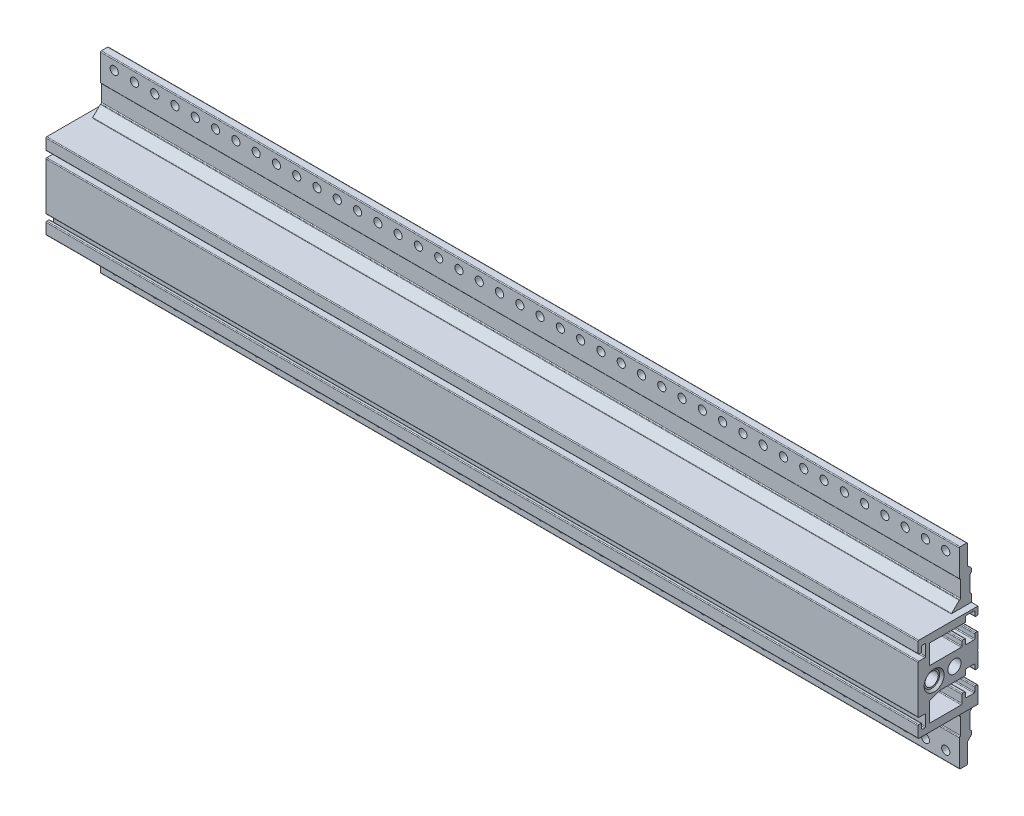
SolidWorks part; units mm, degrees
ref_plane "前视基准面" through (0, 0, 0) normal (0, 0, 1) x (1, 0, 0)
ref_plane "上视基准面" through (0, 0, 0) normal (0, 1, 0) x (1, 0, 0)
ref_plane "右视基准面" through (0, 0, 0) normal (1, 0, 0) x (0, 0, -1)
sketch "草图2" plane through (0, 0, 0) normal (1, 0, 0) x (0, 0, -1)
  line L0 (8.2, 24.1) -> (9.8, 24.1)
  line L1 (-3.8, 10.65) -> (5.9172, 10.65)
  line L2 (7.2, 5.2) -> (7.7, 5.2)
  line L3 (10.4, 5.2) -> (10.8, 5.2)
  line L4 (-1, 3.8) -> (6.8, 3.8)
  line L5 (8.1, 3.8) -> (10, 3.8)
  line L6 (8.1, 10.1) -> (10, 10.1)
  line L7 (-1, 8.7) -> (7.7, 8.7)
  line L8 (10.4, 8.7) -> (10.8, 8.7)
  line L9 (-3.8, 7.65) -> (-3.3, 7.65)
  line L10 (-2.9, 9.15) -> (-2.3, 9.15)
  line L11 (-3.8, 6.1) -> (-2.3, 6.1)
  line L12 (11, 18.0172) -> (11, 17.3)
  line L13 (11, 12.4627) -> (11, 8.9)
  line L14 (10.2, 9.9) -> (10.2, 8.9)
  line L15 (11, 5) -> (11, 1.325)
  line L16 (11, 1.025) -> (11, 0.15)
  line L17 (10.2, 9) -> (10.2, 8.9)
  line L18 (10.2, 5) -> (10.2, 4)
  line L19 (11, 0.15) -> (11, -2.65)
  line L20 (11, -6.55) -> (11, -12.45)
  line L21 (10.2, -1.65) -> (10.2, -2.65)
  line L22 (10.2, -6.55) -> (10.2, -7.55)
  line L23 (7, -6.55) -> (7, -8.5)
  line L24 (7.9, 9.9) -> (7.9, 8.9)
  line L25 (7.9, 5) -> (7.9, 4)
  line L26 (7.9, -1.65) -> (7.9, -2.65)
  line L27 (7.9, -6.55) -> (7.9, -7.55)
  line L28 (-1.2, 8.5) -> (-1.2, 4)
  line L29 (-1.2, -3.9892) -> (-1.2, -8.5)
  line L30 (11, -17.2873) -> (11, -18.0586)
  line L31 (10.7, 16.9127) -> (10.7, 12.85)
  line L32 (10.7, -12.8373) -> (10.7, -16.9)
  line L33 (10, 23.9) -> (10, 19.1828)
  line L34 (10, -19.1828) -> (10, -23.9)
  line L35 (8, 23.9) -> (8, 17.2873)
  line L36 (7, 5) -> (7, 4)
  line L38 (8.3, 16.9) -> (8.3, 12.85)
  line L39 (8.3, -12.85) -> (8.3, -16.9)
  line L40 (9.8, -24.1) -> (8.2, -24.1)
  line L41 (5.9172, -10.65) -> (-3.8, -10.65)
  line L42 (6.8, -8.7) -> (-1, -8.7)
  line L43 (10.7, -2.85) -> (10.5, -2.85)
  line L44 (11, 1.025) -> (10.85, 1.175)
  line L45 (11, 1.325) -> (10.85, 1.175)
  line L46 (10.8, -6.35) -> (10.4, -6.35)
  line L47 (7.7, -6.35) -> (7.2, -6.35)
  line L48 (10.8, -2.85) -> (10.4, -2.85)
  line L49 (7.7, -2.85) -> (1.5358, -2.85)
  line L50 (10, -1.45) -> (8.1, -1.45)
  line L51 (10, -7.75) -> (8.1, -7.75)
  line L52 (-3.3, -7.65) -> (-3.8, -7.65)
  line L53 (-2.3, -9.15) -> (-2.9, -9.15)
  line L54 (-2.3, -6.1) -> (-3.8, -6.1)
  line L55 (-4, -10.45) -> (-4, -7.85)
  line L56 (-4, -5.9) -> (-4, 5.9)
  line L57 (-4, 7.85) -> (-4, 10.45)
  line L58 (-3.1, -8.95) -> (-3.1, -7.85)
  line L59 (-3.1, 7.85) -> (-3.1, 8.95)
  line L60 (-2.1, -8.95) -> (-2.1, -6.3)
  line L61 (-2.1, 6.3) -> (-2.1, 8.95)
  line L62 (10.0586, -19.0414) -> (10.9707, -18.1293)
  line L63 (10.0586, 19.0414) -> (10.9414, 18.1586)
  line L64 (6.0586, 10.7086) -> (7.9418, 12.5918)
  line L65 (-1.0695, -3.8017) -> (1.4664, -2.8625)
  line L66 (8, -17.2873) -> (8, -23.9)
  line L68 (6.0586, -10.7086) -> (7.9418, -12.5918)
  arc A0 (8.3, 16.9) -> (8.15, 17.0936) centre (8.1, 16.9) ccw
  arc A1 (8, 17.2873) -> (8.15, 17.0936) centre (8.2, 17.2873) ccw
  arc A2 (10.85, 17.1064) -> (11, 17.3) centre (10.8, 17.3) ccw
  arc A3 (10.85, 17.1064) -> (10.7, 16.9127) centre (10.9, 16.9127) ccw
  arc A4 (5.9172, 10.65) -> (6.0586, 10.7086) centre (5.9172, 10.85) ccw
  arc A5 (-3.8, 10.65) -> (-4, 10.45) centre (-3.8, 10.45) ccw
  arc A6 (7.2, 5.2) -> (7, 5) centre (7.2, 5) ccw
  arc A7 (10.4, 5.2) -> (10.2, 5) centre (10.4, 5) ccw
  arc A8 (-1.2, 4) -> (-1, 3.8) centre (-1, 4) ccw
  arc A9 (10, 3.8) -> (10.2, 4) centre (10, 4) ccw
  arc A10 (7.9, 4) -> (8.1, 3.8) centre (8.1, 4) ccw
  arc A11 (10.2, 9.9) -> (10, 10.1) centre (10, 9.9) ccw
  arc A12 (7.7, 8.7) -> (7.9, 8.9) centre (7.7, 8.9) ccw
  arc A13 (-1, 8.7) -> (-1.2, 8.5) centre (-1, 8.5) ccw
  arc A14 (-3.3, 7.65) -> (-3.1, 7.85) centre (-3.3, 7.85) ccw
  arc A15 (-2.9, 9.15) -> (-3.1, 8.95) centre (-2.9, 8.95) ccw
  arc A16 (-2.3, 6.1) -> (-2.1, 6.3) centre (-2.3, 6.3) ccw
  arc A17 (8.0916, 12.6502) -> (8.3, 12.85) centre (8.1, 12.85) ccw
  arc A18 (8.0916, 12.6502) -> (7.9418, 12.5918) centre (8.0832, 12.4504) ccw
  arc A19 (10.7, 12.85) -> (10.85, 12.6564) centre (10.9, 12.85) ccw
  arc A20 (11, 12.4627) -> (10.85, 12.6564) centre (10.8, 12.4627) ccw
  arc A21 (11, 18.0172) -> (10.9414, 18.1586) centre (10.8, 18.0172) ccw
  arc A22 (10.8, 8.7) -> (11, 8.9) centre (10.8, 8.9) ccw
  arc A23 (11, 5) -> (10.8, 5.2) centre (10.8, 5) ccw
  arc A24 (10.2, 8.9) -> (10.4, 8.7) centre (10.4, 8.9) ccw
  arc A25 (10.2, -2.65) -> (10.4, -2.85) centre (10.4, -2.65) ccw
  arc A26 (10.4, -6.35) -> (10.2, -6.55) centre (10.4, -6.55) ccw
  arc A27 (7.2, -6.35) -> (7, -6.55) centre (7.2, -6.55) ccw
  arc A28 (6.8, -8.7) -> (7, -8.5) centre (6.8, -8.5) ccw
  arc A29 (8.1, 10.1) -> (7.9, 9.9) centre (8.1, 9.9) ccw
  arc A30 (7.9, 5) -> (7.7, 5.2) centre (7.7, 5) ccw
  arc A31 (8.1, -1.45) -> (7.9, -1.65) centre (8.1, -1.65) ccw
  arc A32 (7.9, -6.55) -> (7.7, -6.35) centre (7.7, -6.55) ccw
  arc A33 (7.9, -7.55) -> (8.1, -7.75) centre (8.1, -7.55) ccw
  arc A34 (-1.0695, -3.8017) -> (-1.2, -3.9892) centre (-1, -3.9892) ccw
  arc A35 (10, 23.9) -> (9.8, 24.1) centre (9.8, 23.9) ccw
  arc A36 (9.8, -24.1) -> (10, -23.9) centre (9.8, -23.9) ccw
  arc A37 (10.0586, -19.0414) -> (10, -19.1828) centre (10.2, -19.1828) ccw
  arc A38 (8.2, 24.1) -> (8, 23.9) centre (8.2, 23.9) ccw
  arc A39 (6.8, 3.8) -> (7, 4) centre (6.8, 4) ccw
  arc A40 (8, -23.9) -> (8.2, -24.1) centre (8.2, -23.9) ccw
  arc A41 (10.7, -16.9) -> (10.85, -17.0936) centre (10.9, -16.9) ccw
  arc A42 (11, -17.2873) -> (10.85, -17.0936) centre (10.8, -17.2873) ccw
  arc A43 (8.15, -17.0936) -> (8.3, -16.9) centre (8.1, -16.9) ccw
  arc A44 (8.15, -17.0936) -> (8, -17.2873) centre (8.2, -17.2873) ccw
  arc A45 (-4, -10.45) -> (-3.8, -10.65) centre (-3.8, -10.45) ccw
  arc A46 (-1.2, -8.5) -> (-1, -8.7) centre (-1, -8.5) ccw
  arc A47 (11, -6.55) -> (10.8, -6.35) centre (10.8, -6.55) ccw
  arc A48 (10.8, -2.85) -> (11, -2.65) centre (10.8, -2.65) ccw
  arc A49 (7.7, -2.85) -> (7.9, -2.65) centre (7.7, -2.65) ccw
  arc A50 (10.2, -1.65) -> (10, -1.45) centre (10, -1.65) ccw
  arc A51 (10, -7.75) -> (10.2, -7.55) centre (10, -7.55) ccw
  arc A52 (-3.1, -7.85) -> (-3.3, -7.65) centre (-3.3, -7.85) ccw
  arc A53 (-2.3, -9.15) -> (-2.1, -8.95) centre (-2.3, -8.95) ccw
  arc A54 (-2.1, -6.3) -> (-2.3, -6.1) centre (-2.3, -6.3) ccw
  arc A55 (10.85, -12.6436) -> (11, -12.45) centre (10.8, -12.45) ccw
  arc A56 (10.85, -12.6436) -> (10.7, -12.8373) centre (10.9, -12.8373) ccw
  arc A57 (-3.8, -7.65) -> (-4, -7.85) centre (-3.8, -7.85) ccw
  arc A58 (-4, -5.9) -> (-3.8, -6.1) centre (-3.8, -5.9) ccw
  arc A59 (-3.8, 6.1) -> (-4, 5.9) centre (-3.8, 5.9) ccw
  arc A60 (-4, 7.85) -> (-3.8, 7.65) centre (-3.8, 7.85) ccw
  arc A61 (-3.1, -8.95) -> (-2.9, -9.15) centre (-2.9, -8.95) ccw
  arc A62 (-2.1, 8.95) -> (-2.3, 9.15) centre (-2.3, 8.95) ccw
  arc A63 (10.9707, -18.1293) -> (11, -18.0586) centre (10.9, -18.0586) ccw
  arc A64 (10, 19.1828) -> (10.0586, 19.0414) centre (10.2, 19.1828) ccw
  arc A65 (1.5358, -2.85) -> (1.4664, -2.8625) centre (1.5358, -3.05) ccw
  circle A66 centre (0, 0) radius 1.6
  arc A70 (5.9172, -10.65) -> (6.0586, -10.7086) centre (5.9172, -10.85) cw
  arc A71 (8.0916, -12.6502) -> (7.9418, -12.5918) centre (8.0832, -12.4504) cw
  arc A72 (8.0916, -12.6502) -> (8.3, -12.85) centre (8.1, -12.85) cw
extrude "凸台-拉伸1" add sketch "草图2" along normal mid plane 431.8
sketch "草图3" plane through (0, 0, 4) normal (0, 0, 1) x (1, 0, 0)
  line L0 (215.9, -10.65) -> (-215.9, -10.65) construction
  line L1 (215.9, -24.1) -> (214.25, -24.1)
  line L2 (215.9, -24.1) -> (215.9, -10.65)
  line L3 (215.9, -10.65) -> (214.25, -10.65)
  line L4 (214.25, -24.1) -> (214.25, -10.65)
  line L6 (0, 0) -> (0, -44.0064) construction
  line L8 (215.9, 24.1) -> (214.25, 24.1)
  line L9 (215.9, 24.1) -> (215.9, 10.65)
  line L10 (215.9, 10.65) -> (214.25, 10.65)
  line L11 (214.25, 24.1) -> (214.25, 10.65)
  line L12 (215.9, 10.65) -> (-215.9, 10.65) construction
  line L13 (-214.25, 24.1) -> (-214.25, 10.65)
  line L14 (-215.9, 10.65) -> (-214.25, 10.65)
  line L15 (-215.9, 24.1) -> (-215.9, 10.65)
  line L16 (-215.9, 24.1) -> (-214.25, 24.1)
  line L17 (-214.25, -24.1) -> (-214.25, -10.65)
  line L18 (-215.9, -10.65) -> (-214.25, -10.65)
  line L19 (-215.9, -24.1) -> (-215.9, -10.65)
  line L20 (-215.9, -24.1) -> (-214.25, -24.1)
  dimension "D1" = 1.65
extrude "切除-拉伸1" cut sketch "草图3" against normal through all
sketch "草图4" plane through (0, 0, -10) normal (0, 0, -1) x (-1, 0, 0)
  line L0 (-215.9, 10.65) -> (-215.9, 8.9) construction
  line L2 (-214.25, 24.1) -> (-234.25, 24.1) construction
  line L3 (-214.25, -24.1) -> (-234.25, -24.1) construction
  line L4 (-224.25, 24.1) -> (-224.25, -24.1) construction
  line L5 (-224.25, 0) -> (-201.0943, 0) construction
  circle A0 centre (-210.82, 21.65) radius 0.75
  circle A1 centre (-210.82, -21.65) radius 0.75
  circle A2 centre (-205.74, 21.65) radius 0.75
  circle A3 centre (-205.74, -21.65) radius 0.75
  circle A4 centre (-200.66, 21.65) radius 0.75
  circle A5 centre (-200.66, -21.65) radius 0.75
  circle A6 centre (-195.58, 21.65) radius 0.75
  circle A7 centre (-195.58, -21.65) radius 0.75
  circle A8 centre (-190.5, 21.65) radius 0.75
  circle A9 centre (-190.5, -21.65) radius 0.75
  circle A10 centre (-185.42, 21.65) radius 0.75
  circle A11 centre (-185.42, -21.65) radius 0.75
  circle A12 centre (-180.34, 21.65) radius 0.75
  circle A13 centre (-180.34, -21.65) radius 0.75
  circle A14 centre (-175.26, 21.65) radius 0.75
  circle A15 centre (-175.26, -21.65) radius 0.75
  circle A16 centre (-170.18, 21.65) radius 0.75
  circle A17 centre (-170.18, -21.65) radius 0.75
  circle A18 centre (-165.1, 21.65) radius 0.75
  circle A19 centre (-165.1, -21.65) radius 0.75
  circle A20 centre (-160.02, 21.65) radius 0.75
  circle A21 centre (-160.02, -21.65) radius 0.75
  circle A22 centre (-154.94, 21.65) radius 0.75
  circle A23 centre (-154.94, -21.65) radius 0.75
  circle A24 centre (-149.86, 21.65) radius 0.75
  circle A25 centre (-149.86, -21.65) radius 0.75
  circle A26 centre (-144.78, 21.65) radius 0.75
  circle A27 centre (-144.78, -21.65) radius 0.75
  circle A28 centre (-139.7, 21.65) radius 0.75
  circle A29 centre (-139.7, -21.65) radius 0.75
  circle A30 centre (-134.62, 21.65) radius 0.75
  circle A31 centre (-134.62, -21.65) radius 0.75
  circle A32 centre (-129.54, 21.65) radius 0.75
  circle A33 centre (-129.54, -21.65) radius 0.75
  circle A34 centre (-124.46, 21.65) radius 0.75
  circle A35 centre (-124.46, -21.65) radius 0.75
  circle A36 centre (-119.38, 21.65) radius 0.75
  circle A37 centre (-119.38, -21.65) radius 0.75
  circle A38 centre (-114.3, 21.65) radius 0.75
  circle A39 centre (-114.3, -21.65) radius 0.75
  circle A40 centre (-109.22, 21.65) radius 0.75
  circle A41 centre (-109.22, -21.65) radius 0.75
  circle A42 centre (-104.14, 21.65) radius 0.75
  circle A43 centre (-104.14, -21.65) radius 0.75
  circle A44 centre (-99.06, 21.65) radius 0.75
  circle A45 centre (-99.06, -21.65) radius 0.75
  circle A46 centre (-93.98, 21.65) radius 0.75
  circle A47 centre (-93.98, -21.65) radius 0.75
  circle A48 centre (-88.9, 21.65) radius 0.75
  circle A49 centre (-88.9, -21.65) radius 0.75
  circle A50 centre (-83.82, 21.65) radius 0.75
  circle A51 centre (-83.82, -21.65) radius 0.75
  circle A52 centre (-78.74, 21.65) radius 0.75
  circle A53 centre (-78.74, -21.65) radius 0.75
  circle A54 centre (-73.66, 21.65) radius 0.75
  circle A55 centre (-73.66, -21.65) radius 0.75
  circle A56 centre (-68.58, 21.65) radius 0.75
  circle A57 centre (-68.58, -21.65) radius 0.75
  circle A58 centre (-63.5, 21.65) radius 0.75
  circle A59 centre (-63.5, -21.65) radius 0.75
  circle A60 centre (-58.42, 21.65) radius 0.75
  circle A61 centre (-58.42, -21.65) radius 0.75
  circle A62 centre (-53.34, 21.65) radius 0.75
  circle A63 centre (-53.34, -21.65) radius 0.75
  circle A64 centre (-48.26, 21.65) radius 0.75
  circle A65 centre (-48.26, -21.65) radius 0.75
  circle A66 centre (-43.18, 21.65) radius 0.75
  circle A67 centre (-43.18, -21.65) radius 0.75
  circle A68 centre (-38.1, 21.65) radius 0.75
  circle A69 centre (-38.1, -21.65) radius 0.75
  circle A70 centre (-33.02, 21.65) radius 0.75
  circle A71 centre (-33.02, -21.65) radius 0.75
  circle A72 centre (-27.94, 21.65) radius 0.75
  circle A73 centre (-27.94, -21.65) radius 0.75
  circle A74 centre (-22.86, 21.65) radius 0.75
  circle A75 centre (-22.86, -21.65) radius 0.75
  circle A76 centre (-17.78, 21.65) radius 0.75
  circle A77 centre (-17.78, -21.65) radius 0.75
  circle A78 centre (-12.7, 21.65) radius 0.75
  circle A79 centre (-12.7, -21.65) radius 0.75
  circle A80 centre (-7.62, 21.65) radius 0.75
  circle A81 centre (-7.62, -21.65) radius 0.75
  circle A82 centre (-2.54, 21.65) radius 0.75
  circle A83 centre (-2.54, -21.65) radius 0.75
  circle A84 centre (2.54, 21.65) radius 0.75
  circle A85 centre (2.54, -21.65) radius 0.75
  circle A86 centre (7.62, 21.65) radius 0.75
  circle A87 centre (7.62, -21.65) radius 0.75
  circle A88 centre (12.7, 21.65) radius 0.75
  circle A89 centre (12.7, -21.65) radius 0.75
  circle A90 centre (17.78, 21.65) radius 0.75
  circle A91 centre (17.78, -21.65) radius 0.75
  circle A92 centre (22.86, 21.65) radius 0.75
  circle A93 centre (22.86, -21.65) radius 0.75
  circle A94 centre (27.94, 21.65) radius 0.75
  circle A95 centre (27.94, -21.65) radius 0.75
  circle A96 centre (33.02, 21.65) radius 0.75
  circle A97 centre (33.02, -21.65) radius 0.75
  circle A98 centre (38.1, 21.65) radius 0.75
  circle A99 centre (38.1, -21.65) radius 0.75
  circle A100 centre (43.18, 21.65) radius 0.75
  circle A101 centre (43.18, -21.65) radius 0.75
  circle A102 centre (48.26, 21.65) radius 0.75
  circle A103 centre (48.26, -21.65) radius 0.75
  circle A104 centre (53.34, 21.65) radius 0.75
  circle A105 centre (53.34, -21.65) radius 0.75
  circle A106 centre (58.42, 21.65) radius 0.75
  circle A107 centre (58.42, -21.65) radius 0.75
  circle A108 centre (63.5, 21.65) radius 0.75
  circle A109 centre (63.5, -21.65) radius 0.75
  circle A110 centre (68.58, 21.65) radius 0.75
  circle A111 centre (68.58, -21.65) radius 0.75
  circle A112 centre (73.66, 21.65) radius 0.75
  circle A113 centre (73.66, -21.65) radius 0.75
  circle A114 centre (78.74, 21.65) radius 0.75
  circle A115 centre (78.74, -21.65) radius 0.75
  circle A116 centre (83.82, 21.65) radius 0.75
  circle A117 centre (83.82, -21.65) radius 0.75
  circle A118 centre (88.9, 21.65) radius 0.75
  circle A119 centre (88.9, -21.65) radius 0.75
  circle A120 centre (93.98, 21.65) radius 0.75
  circle A121 centre (93.98, -21.65) radius 0.75
  circle A122 centre (99.06, 21.65) radius 0.75
  circle A123 centre (99.06, -21.65) radius 0.75
  circle A124 centre (104.14, 21.65) radius 0.75
  circle A125 centre (104.14, -21.65) radius 0.75
  circle A126 centre (109.22, 21.65) radius 0.75
  circle A127 centre (109.22, -21.65) radius 0.75
  circle A128 centre (114.3, 21.65) radius 0.75
  circle A129 centre (114.3, -21.65) radius 0.75
  circle A130 centre (119.38, 21.65) radius 0.75
  circle A131 centre (119.38, -21.65) radius 0.75
  circle A132 centre (124.46, 21.65) radius 0.75
  circle A133 centre (124.46, -21.65) radius 0.75
  circle A134 centre (129.54, 21.65) radius 0.75
  circle A135 centre (129.54, -21.65) radius 0.75
  circle A136 centre (134.62, 21.65) radius 0.75
  circle A137 centre (134.62, -21.65) radius 0.75
  circle A138 centre (139.7, 21.65) radius 0.75
  circle A139 centre (139.7, -21.65) radius 0.75
  circle A140 centre (144.78, 21.65) radius 0.75
  circle A141 centre (144.78, -21.65) radius 0.75
  circle A142 centre (149.86, 21.65) radius 0.75
  circle A143 centre (149.86, -21.65) radius 0.75
  circle A144 centre (154.94, 21.65) radius 0.75
  circle A145 centre (154.94, -21.65) radius 0.75
  circle A146 centre (160.02, 21.65) radius 0.75
  circle A147 centre (160.02, -21.65) radius 0.75
  circle A148 centre (165.1, 21.65) radius 0.75
  circle A149 centre (165.1, -21.65) radius 0.75
  circle A150 centre (170.18, 21.65) radius 0.75
  circle A151 centre (170.18, -21.65) radius 0.75
  circle A152 centre (175.26, 21.65) radius 0.75
  circle A153 centre (175.26, -21.65) radius 0.75
  circle A154 centre (180.34, 21.65) radius 0.75
  circle A155 centre (180.34, -21.65) radius 0.75
  circle A156 centre (185.42, 21.65) radius 0.75
  circle A157 centre (185.42, -21.65) radius 0.75
  circle A158 centre (190.5, 21.65) radius 0.75
  circle A159 centre (190.5, -21.65) radius 0.75
  circle A160 centre (195.58, 21.65) radius 0.75
  circle A161 centre (195.58, -21.65) radius 0.75
  circle A162 centre (200.66, 21.65) radius 0.75
  circle A163 centre (200.66, -21.65) radius 0.75
  circle A164 centre (205.74, 21.65) radius 0.75
  circle A165 centre (205.74, -21.65) radius 0.75
  circle A166 centre (210.82, 21.65) radius 0.75
  circle A167 centre (210.82, -21.65) radius 0.75
  dimension "D1" = 1.5
  dimension "D2" = 5.08
  dimension "D3" = 20
  dimension "D4" = 43.3
  dimension "D6" = 5.08
  dimension "D5" = 84
extrude "切除-拉伸2" cut sketch "草图4" against normal through all
hole_wizard "M2.5 螺纹孔1" positions "3D草图1" profile "草图5" tap size "M2.5" standard "Gb"
sketch3d "3D草图1"
  line L0 (210.82, 21.65, -8) -> (210.82, 21.65, -10) construction
  line L1 (210.82, -21.65, -8) -> (210.82, -21.65, -10) construction
  point P0 (210.82, 21.65, -10)
  point P4 (210.82, -21.65, -10)
sketch "草图5" plane through (210.82, 21.65, -10) normal (1, 0, 0) x (0, 1, 0)
  line L0 (0, 0) -> (0, 14)
  line L1 (0, 14) -> (1.025, 14)
  line L2 (1.025, 14) -> (1.025, 0)
  line L5 (1.025, 0) -> (0, 0)
  line L11 (0, -6.35) -> (0, 107.95) construction
  dimension "通孔螺纹孔钻头直径" = 2.05
  dimension "通孔螺纹孔钻头深度" = 14
pattern_linear "阵列(线性)1" count 84 spacing 5.08 along (-1, 0, 0) of "M2.5 螺纹孔1"
hole_wizard "M4 螺纹孔1" positions "3D草图2" profile "草图6" tap size "M4" standard "Gb"
sketch3d "3D草图2"
  line L0 (215.9, 0, 0) -> (-215.9, 0, 0) construction
  point P0 (0, 0, 0)
  point P4 (-215.9, 0, 0)
  point P8 (215.9, 0, 0)
sketch "草图6" plane through (-215.9, 0, 0) normal (0, 1, 0) x (0, 0, 1)
  line L0 (0, 0) -> (0, 15.0914)
  line L1 (0, 15.0914) -> (1.65, 14.1)
  line L2 (1.65, 14.1) -> (1.65, 0)
  line L5 (1.65, 0) -> (0, 0)
  line L10 (0, 15.0914) -> (-1.65, 14.1) construction
  line L11 (0, -6.35) -> (0, 107.95) construction
  dimension "螺纹孔钻头直径" = 3.3
  dimension "螺纹孔钻头深度" = 14.1
  dimension "导头角度" = 118
chamfer "倒角1" distance 0.6 angle 45 2 edges at (215.9, 0, -1.65) (-215.9, 0, 1.65)
sketch "草图7" plane through (-215.9, 0, 0) normal (-1, 0, 0) x (0, 0, 1)
  circle A0 centre (-5.1, 0.5) radius 1.65
  circle A1 centre (0, 0) radius 1.65 construction
  circle A2 centre (0, 0) radius 2.25 construction
  dimension "D1" = 5.1
  dimension "D2" = 0.5
  dimension "D3" = 3.3
extrude "切除-拉伸3" cut sketch "草图7" against normal blind 20
sketch "草图8" plane through (-214.25, 0, 0) normal (-1, 0, 0) x (0, 0, 1)
  line L0 (-5.8819, -10.65) -> (-8, -10.65)
  line L1 (-11, -10.65) -> (3.8, -10.65) construction
  line L2 (-11, -10.65) -> (-5.9172, -10.65) construction
  line L3 (-8, -10.65) -> (-8, -13.2407)
  line L4 (-8, -13.2407) -> (-5.8819, -10.65)
  line L5 (-11, -12.45) -> (-11, -10.65) construction
  dimension "D1" = 3
extrude "切除-拉伸4" cut sketch "草图8" against normal through all
fillet "圆角1" radius 0.2 2 edges at (0, -12.6322, -8) (0, -10.65, -8)
sketch "草图9" plane through (215.9, 0, 0) normal (1, 0, 0) x (0, 0, -1)
  circle A0 centre (5.1, 0.5) radius 1.65
  circle A1 centre (0, 0) radius 2.25 construction
  dimension "D1" = 3.3
  dimension "D2" = 5.1
  dimension "D3" = 0.5
extrude "切除-拉伸5" cut sketch "草图9" against normal blind 20
sketch "草图10" plane through (0, 0, 4) normal (0, 0, 1) x (1, 0, 0)
  line L0 (-215.9, -5.9) -> (-215.9, 5.9) construction
  line L1 (215.9, 39.2787) -> (2.54, 39.2787)
  line L2 (215.9, 39.2787) -> (215.9, -44.6046)
  line L3 (215.9, -44.6046) -> (2.54, -44.6046)
  line L4 (2.54, 39.2787) -> (2.54, -44.6046)
  line L5 (215.9, -5.9) -> (215.9, 5.9) construction
  dimension "D1" = 218.44
extrude "切除-拉伸6" cut sketch "草图10" against normal blind 23
sketch "草图12" plane through (0, 0, 4) normal (0, 0, 1) x (1, 0, 0)
  line L1 (2.54, 24.1) -> (0.89, 24.1)
  line L2 (2.54, 24.1) -> (2.54, 10.65)
  line L3 (2.54, 10.65) -> (0.89, 10.65)
  line L4 (0.89, 24.1) -> (0.89, 10.65)
  line L5 (2.54, -24.1) -> (0.89, -24.1)
  line L6 (2.54, -24.1) -> (2.54, -10.65)
  line L7 (2.54, -10.65) -> (0.89, -10.65)
  line L8 (0.89, -24.1) -> (0.89, -10.65)
  dimension "D1" = 1.65
  dimension "D2" = 13.45
  dimension "D3" = 1.65
  dimension "D4" = 13.45
extrude "切除-拉伸7" cut sketch "草图12" against normal blind 23
hole_wizard "M4 螺纹孔3" positions "草图18" profile "草图17" tap size "M4" standard "GB"
sketch "草图18" plane through (2.54, 0, 0) normal (1, 0, 0) x (0, 0, -1)
  point P0 (0, 0)
sketch "草图17" plane through (2.54, 0, 0) normal (0, 1, 0) x (0, 0, -1)
  line L0 (0, 0) -> (0, 15.7914)
  line L1 (0, 15.7914) -> (1.65, 14.8)
  line L2 (1.65, 14.8) -> (1.65, 0)
  line L5 (1.65, 0) -> (0, 0)
  line L10 (0, 15.7914) -> (-1.65, 14.8) construction
  line L11 (0, -6.35) -> (0, 107.95) construction
  dimension "螺纹孔钻头直径" = 3.3
  dimension "螺纹孔钻头深度" = 14.8
  dimension "导头角度" = 118
sketch "草图20" plane through (2.54, 0, 0) normal (1, 0, 0) x (0, 0, -1)
  circle A0 centre (0, 0) radius 2
extrude "切除-拉伸8" cut sketch "草图20" against normal blind 0.6
chamfer "倒角3" distance 0.5 distance2 0.6 1 edges at (2.54, 2, 0)
sketch "草图21" plane through (2.54, 0, 0) normal (1, 0, 0) x (0, 0, -1)
  circle A0 centre (5.1, 0.5) radius 1.65
extrude "切除-拉伸9" cut sketch "草图21" against normal blind 20
